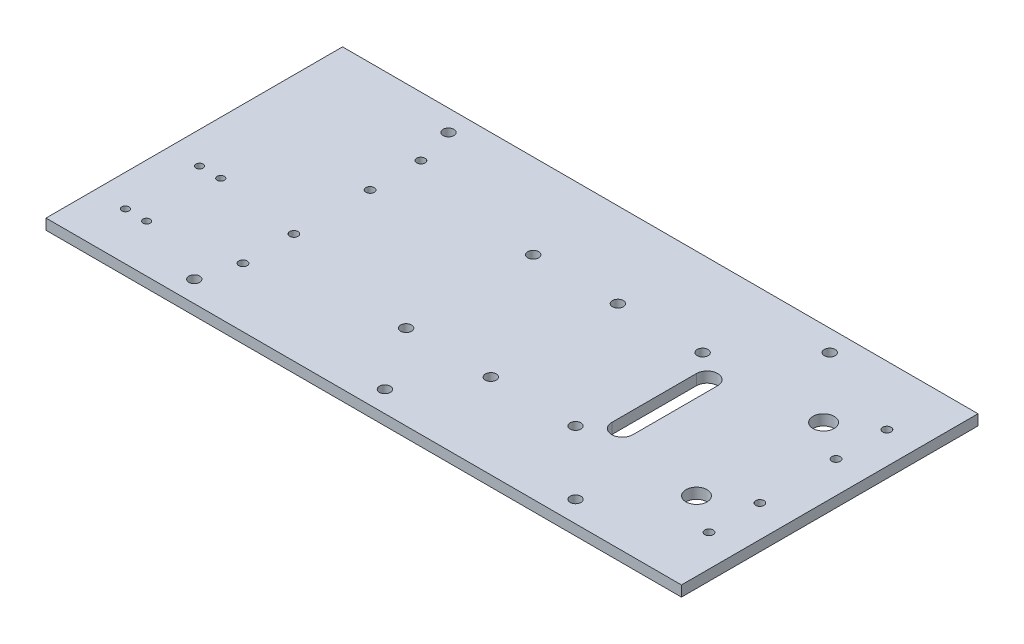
SolidWorks part; units mm, degrees
ref_plane "Front Plane" through (0, 0, 0) normal (0, 0, 1) x (1, 0, 0)
ref_plane "Top Plane" through (0, 0, 0) normal (0, 1, 0) x (1, 0, 0)
ref_plane "Right Plane" through (0, 0, 0) normal (1, 0, 0) x (0, 0, -1)
sketch "Sketch1" plane through (0, 0, 0) normal (0, 1, 0) x (1, 0, 0)
  line L1 (-190.5, -88.9) -> (190.5, -88.9)
  line L2 (-190.5, -88.9) -> (-190.5, 88.9)
  line L3 (-190.5, 88.9) -> (190.5, 88.9)
  line L4 (190.5, -88.9) -> (190.5, 88.9)
  point P4 (0, 88.9)
  point P6 (-190.5, 0)
  dimension "D1" = 381
  dimension "D2" = 177.8
extrude "Plate" add sketch "Sketch1" along normal blind 6.35
sketch "Sketch2" plane through (0, 0, 88.9) normal (0, 0, 1) x (1, 0, 0)
  line L1 (-190.5, 0) -> (190.5, 0)
  line L2 (-190.5, 0) -> (-190.5, 31.75)
  line L3 (-190.5, 31.75) -> (190.5, 31.75)
  line L4 (190.5, 0) -> (190.5, 31.75)
  dimension "D1" = 31.75
extrude "Boss-Extrude2" [suppressed] add sketch "Sketch2" along normal blind 6.35
sketch "Sketch3" [suppressed] plane through (0, 0, 95.25) normal (0, 0, 1) x (1, 0, 0)
  line L0 (0, 0) -> (0, 31.75) construction
  line L1 (-190.5, 0) -> (190.5, 0) construction
  line L2 (190.5, 31.75) -> (-190.5, 31.75) construction
  circle A0 centre (0, 19.05) radius 3.175
  circle A1 centre (-127, 19.05) radius 3.175
  circle A2 centre (127, 19.05) radius 3.175
  dimension "D1" = 6.35
  dimension "D2" = 12.7
  dimension "D3" = 127
  dimension "D4" = 127
extrude "Cut-Extrude1" [suppressed] cut sketch "Sketch3" against normal up to surface (6.35 mm away)
sketch "Sketch4" plane through (0, 0, 0) normal (0, -1, 0) x (1, 0, 0)
  line L2 (190.5, -88.9) -> (-190.5, -88.9) construction
  circle A0 centre (0, 76.2) radius 3.2639
  circle A1 centre (-114.3, 76.2) radius 3.2639
  circle A2 centre (114.3, 76.2) radius 3.2639
  circle A3 centre (-114.3, -76.2) radius 3.2639
  circle A5 centre (114.3, -76.2) radius 3.2639
  dimension "D2" = 6.5278
  dimension "D3" = 114.3
  dimension "D5" = 12.7
  dimension "D1" = 76.2
  dimension "D4" = 114.3
extrude "ChassisMountingHoles" cut sketch "Sketch4" against normal up to surface (6.35 mm away)
sketch "Sketch5" plane through (0, 0, 0) normal (0, -1, 0) x (1, 0, 0)
  line L0 (190.5, 88.9) -> (190.5, -88.9) construction
  line L3 (0, 0) -> (0, 229.4543) construction
  line L4 (171.45, 22.86) -> (171.45, 53.34) construction
  line L5 (0, 0) -> (353.5615, 0) construction
  circle A2 centre (171.45, 53.34) radius 2.5019
  circle A8 centre (171.45, 22.86) radius 2.5019
  circle A14 centre (-107.95, 53.34) radius 2.5019
  circle A15 centre (-107.95, 22.86) radius 2.5019
  circle A16 centre (171.45, -53.34) radius 2.5019
  circle A17 centre (171.45, -22.86) radius 2.5019
  circle A18 centre (-107.95, -22.86) radius 2.5019
  circle A19 centre (-107.95, -53.34) radius 2.5019
  dimension "D1" = 5.0038
  dimension "D2" = 19.05
  dimension "D5" = 30.48
  dimension "D6" = 279.4
extrude "LeadScrewGuideMounts" cut sketch "Sketch5" against normal up to surface (6.35 mm away)
sketch "Sketch6" plane through (0, 0, 0) normal (0, -1, 0) x (1, 0, 0)
  line L0 (-190.5, -88.9) -> (-190.5, 88.9) construction
  line L1 (-190.5, 88.9) -> (190.5, 88.9) construction
  circle A0 centre (-171.45, 60.325) radius 2.1527
  circle A1 centre (-158.75, 60.325) radius 2.1527
  circle A2 centre (-171.45, 15.875) radius 2.1527
  circle A3 centre (-158.75, 15.875) radius 2.1527
  dimension "D3" = 4.3053
  dimension "D1" = 12.7
  dimension "D2" = 19.05
  dimension "D4" = 44.45
  dimension "D5" = 28.575
extrude "LeadScrewMotorMount" cut sketch "Sketch6" against normal up to surface (6.35 mm away)
sketch "Sketch8" plane through (0, 0, 0) normal (0, -1, 0) x (1, 0, 0)
  circle A0 centre (-25.4, 38.1) radius 3.2639
  circle A1 centre (25.4, 38.1) radius 3.2639
  circle A2 centre (76.2, 38.1) radius 3.2639
  point P6 (0, 0)
  point P9 (0, 0)
  dimension "D1" = 6.5278
  dimension "D2" = 38.1
  dimension "D3" = 25.4
  dimension "D4" = 50.8
  dimension "D5" = 101.6
extrude "Cut-Extrude2" cut sketch "Sketch8" against normal through all
mirror "Mirror1" about plane through (0, 0, 0) normal (0, 0, 1) of "Cut-Extrude2"
sketch "Sketch9" plane through (0, 0, 0) normal (0, -1, 0) x (1, 0, 0)
  line L0 (0, 0) -> (280.1167, 0) construction
  line L4 (85.217, 25.4) -> (85.217, 0)
  line L5 (85.217, 0) -> (97.917, 0)
  line L6 (97.917, 0) -> (97.917, 25.4)
  circle A0 centre (148.717, 38.1) radius 6.35
  arc A1 (97.917, 25.4) -> (85.217, 25.4) centre (91.567, 25.4) ccw
  circle A4 centre (76.2, 38.1) radius 3.2639 construction
  dimension "D2" = 72.517
  dimension "D3" = 12.7
  dimension "D4" = 57.15
  dimension "D6" = 12.7
  dimension "D1" = 38.1
  dimension "D5" = 25.4
extrude "Cut-Extrude3" cut sketch "Sketch9" against normal through all
mirror "Mirror2" about plane through (0, 0, 0) normal (0, 0, 1) of "Cut-Extrude3"
